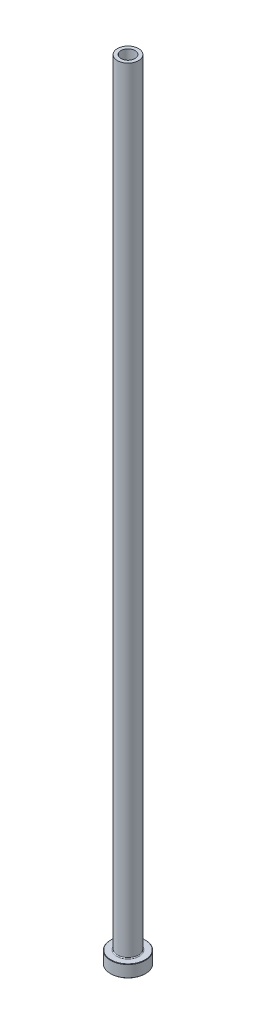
SolidWorks part; units mm, degrees
ref_plane "Front Plane" through (0, 0, 0) normal (0, 0, 1) x (1, 0, 0)
ref_plane "Top Plane" through (0, 0, 0) normal (0, 1, 0) x (1, 0, 0)
ref_plane "Right Plane" through (0, 0, 0) normal (1, 0, 0) x (0, 0, -1)
sketch "Sketch1" plane through (0, 0, 0) normal (0, 0, 1) x (1, 0, 0)
  line L0 (-4, 450) -> (-6, 450)
  line L1 (-6, 450) -> (-6, 7)
  line L2 (-6, 7) -> (-10, 7)
  line L3 (-10, 7) -> (-10, 0)
  line L4 (11, 0) -> (-11, 0) construction
  line L5 (-10, 0) -> (-4.25, 0)
  line L6 (-4, 405) -> (-4, 450)
  line L7 (0, 92.1877) -> (0, -15.5353) construction
  line L8 (0, -11) -> (0, 11) construction
  line L9 (-4, 405) -> (-4.25, 393)
  line L10 (-4.25, 393) -> (-4.25, 0)
  dimension "D1" = 0.25
  dimension "ID" = 8
  dimension "OD" = 12
  dimension "L" = 450
  dimension "H" = 20
  dimension "T" = 7
  dimension "N" = 45
  dimension "D2" = 12
revolve "Revolve1" add sketch "Sketch1" angle 360 about L7
fillet "Fillet1" radius 0.5 1 edges at (0, 7, 6)
chamfer "Chamfer1" distance 0.2 angle 45 2 edges at (0, 7, 10) (0, 0, 10)
chamfer "Chamfer3" distance 0.5 angle 45 1 edges at (0, 0, 4.25)
